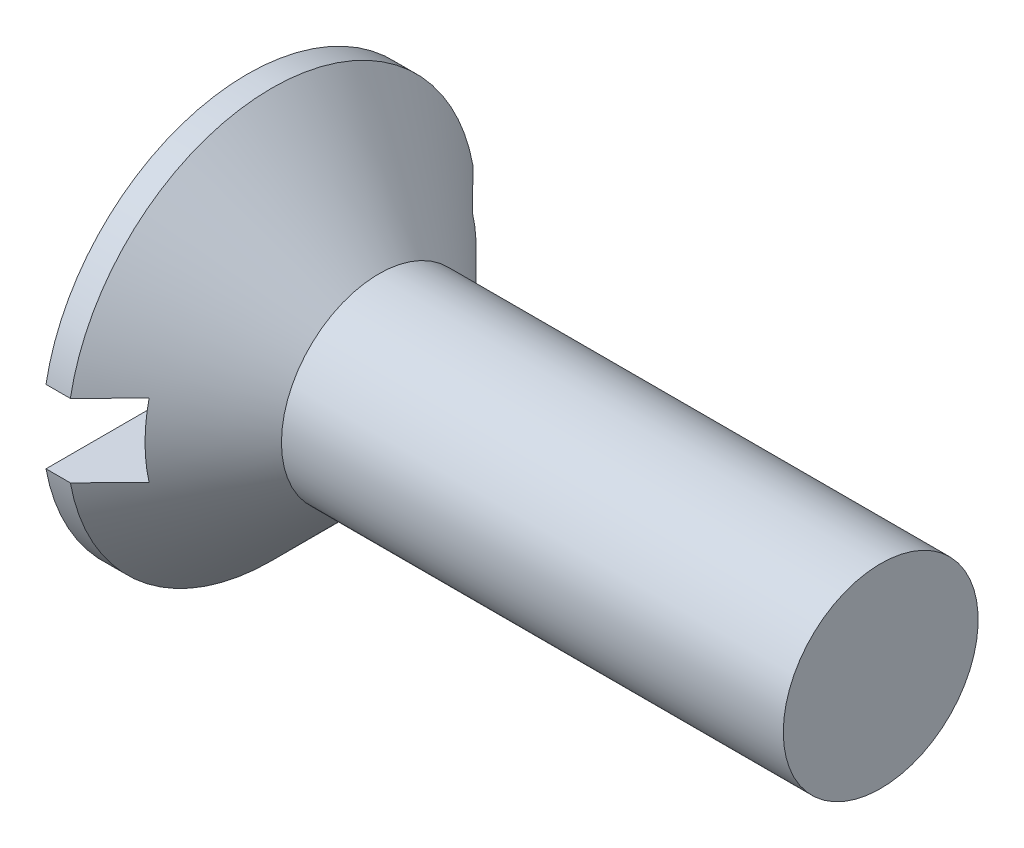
SolidWorks part; units mm, degrees
ref_plane "Plane1" through (0, 0, 0) normal (0, 0, 1) x (1, 0, 0)
ref_plane "Plane2" through (0, 0, 0) normal (0, 1, 0) x (1, 0, 0)
ref_plane "Plane3" through (0, 0, 0) normal (1, 0, 0) x (0, 0, -1)
sketch "BodySke" plane through (0, 0, 0) normal (0, 0, 1) x (1, 0, 0)
  line L0 (0, 0) -> (0, 4.2)
  line L1 (0, 4.2) -> (0.5, 4.2)
  line L2 (2.7, 2) -> (13, 2)
  line L3 (13, 2) -> (13, 0)
  line L4 (13, 0) -> (0, 0)
  line L5 (-6.35, 0) -> (82.55, 0) construction
  line L6 (2.7, -2) -> (13, -2) construction
  line L7 (0.5, -4.2) -> (2.7, -2) construction
  line L8 (0.5, 4.2) -> (2.7, 2)
  line L9 (0, -4.2) -> (0.5, -4.2) construction
  line L10 (3.4, 3.5875) -> (3.4, -5.9375) construction
  line L11 (0, 6.35) -> (0, -3.175) construction
  dimension "Diameter" = 4
  dimension "Length" = 13
  dimension "Head_ht" = 2.7
  dimension "Head_dia" = 8.4
  dimension "Head_ang" = 90
  dimension "D6" = 0.5
  dimension "Advance" = 0.7
  dimension "Thread_nom" = 13
revolve "Base-Revolve" add sketch "BodySke" angle 360 about L5
sketch "Sketch2" plane through (0, 0, 0) normal (-1, 0, 0) x (0, 0, 1)
  line L0 (-4.2, -0.75) -> (4.2, -0.75)
  line L1 (-4.2, -0.75) -> (-4.2, 0.75)
  line L2 (4.2, 0.75) -> (-4.2, 0.75)
  line L3 (4.2, 0.75) -> (4.2, -0.75)
  dimension "D1" = 0.75
  dimension "Slot_width" = 1.5
  dimension "D2" = 8.4
  dimension "D3" = 4.2
extrude "Slot" cut sketch "Sketch2" against normal blind 1.3
sketch "Sketch3" plane through (0, 0, 0) normal (-1, 0, 0) x (0, 0, 1)
  line L0 (-0.48, 2.23) -> (0.48, 2.23)
  line L1 (0.48, 2.23) -> (0.48, -2.23)
  line L2 (0.48, -2.23) -> (-0.48, -2.23)
  line L3 (-0.48, -2.23) -> (-0.48, 2.23)
  dimension "D1" = 2.23
  dimension "Cross_dia" = 4.46
  dimension "D2" = 0.48
  dimension "Cross_width" = 0.96
ref_plane "Plane4" through (2.65, 0, 0) normal (-1, 0, 0) x (0, 0, 1)
sketch "Sketch4" plane through (2.65, 0, 0) normal (-1, 0, 0) x (0, 0, 1)
  line L0 (-0.24, 0.24) -> (0.24, 0.24)
  line L3 (0.24, 0.24) -> (0.24, -0.24)
  line L4 (0.24, -0.24) -> (-0.24, -0.24)
  line L5 (-0.24, -0.24) -> (-0.24, 0.24)
  dimension "D1" = 0.48
  dimension "D2" = 0.48
  dimension "D3" = 0.24
  dimension "D4" = 0.24
loft "Cross" [suppressed] cut profiles "Sketch3", "Sketch4"
pattern_circular "CirPattern1" [suppressed] count 2 every 90 about axis through (-6.35, 0, 0) along (1, 0, 0)
sketch "ThdSchSke" plane through (0, 0, 0) normal (0, 0, 1) x (1, 0, 0)
  line L0 (3.4, -1.61) -> (3.1269, -2)
  line L1 (3.4, -1.61) -> (3.6731, -2)
  line L2 (3.6731, -2) -> (3.6731, -2.5)
  line L3 (-3.175, 0) -> (5.1513, 0) construction
  line L5 (3.6731, -2.5) -> (3.1269, -2.5)
  line L6 (3.1269, -2.5) -> (3.1269, -2)
  line L7 (0, 4.2) -> (0, 0.75) construction
  dimension "Thread_minor" = 3.22
  dimension "Diameter" = 4
  dimension "Start" = 3.4
  dimension "SideAngle" = 55
  dimension "VeeAngle" = 70
  dimension "Overcut" = 5
revolve "ThreadSchematic" [suppressed] cut sketch "ThdSchSke" angle 360 about L3
pattern_linear "ThdSchPat" [suppressed]
equation "\"D1@Sketch3\" = \"Cross_dia@Sketch3\" / 2"
equation "\"D2@Sketch3\" = \"Cross_width@Sketch3\" / 2"
equation "\"D1@Sketch4\" = \"Cross_width@Sketch3\" *.5"
equation "\"D2@Sketch4\" = \"D1@Sketch4\""
equation "\"D4@Sketch4\" = \"D2@Sketch4\" / 2"
equation "\"D3@Sketch4\" = \"D1@Sketch4\" / 2"
equation "\"D1@Sketch2\" = \"Slot_width@Sketch2\" / 2"
equation "\"D2@Sketch2\" = \"Head_dia@BodySke\""
equation "\"D3@Sketch2\" = \"D2@Sketch2\" / 2"
equation "\"Thread_length@ThreadCosmetic\" = ((sgn( (\"Length@BodySke\" - \"Advance@BodySke\" - \"Head_ht@BodySke\" ) - \"Thread_nom@BodySke\" )-1)*( (\"Length@BodySke\" - \"Advance@BodySke\" - \"Head_ht@BodySke\" ) - \"Thread_"
equation "\"Thread_minor@ThdSchSke\" = \"Thread_minor@ThreadCosmetic\""
equation "\"Diameter@ThdSchSke\" = \"Diameter@BodySke\""
equation "\"Overcut@ThdSchSke\" = \"Diameter@BodySke\" * 1.25"
equation "\"Start@ThdSchSke\" = 0.000001 + \"Length@BodySke\" - \"Thread_length@ThreadCosmetic\"  '---Countersunk---"
equation "\"Num_threads@ThdSchPat\" = int( \"Thread_length@ThreadCosmetic\" / \"Advance@BodySke\" + 0.999 )  + 1"
equation "\"Advance@ThdSchPat\" = \"Thread_length@ThreadCosmetic\" /  (\"Num_threads@ThdSchPat\" - 1) 'relax it"
